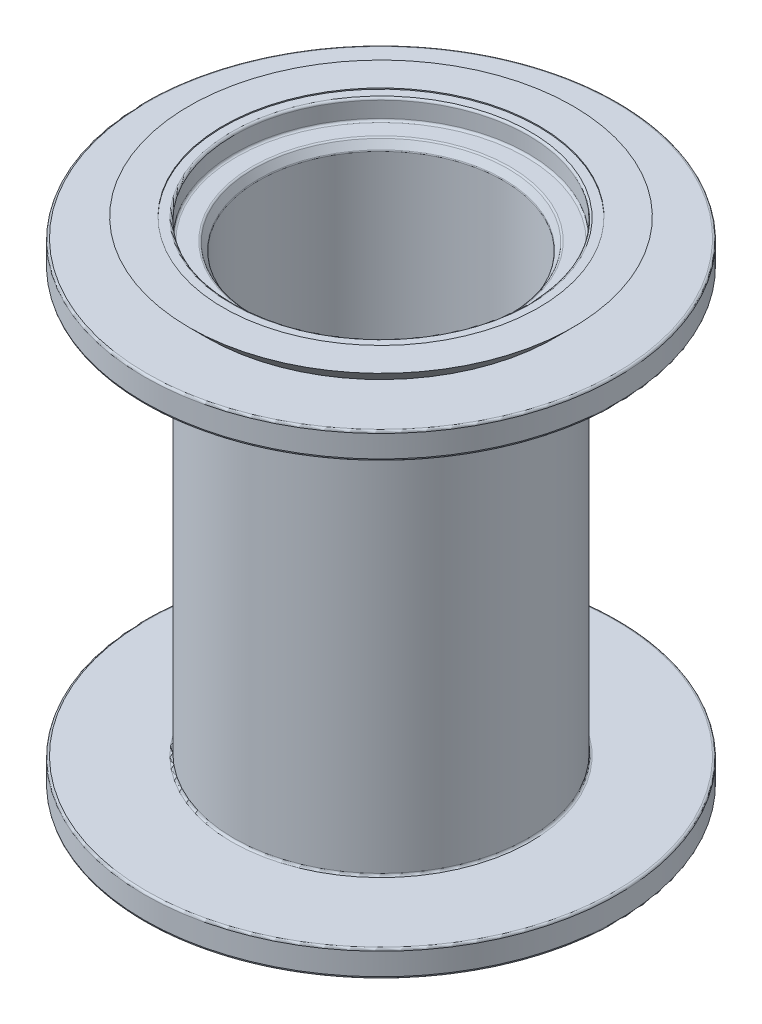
SolidWorks part; units mm, degrees
ref_plane "Plan de face" through (0, 0, 0) normal (0, 0, 1) x (1, 0, 0)
ref_plane "Plan de dessus" through (0, 0, 0) normal (0, 1, 0) x (1, 0, 0)
ref_plane "Plan de droite" through (0, 0, 0) normal (1, 0, 0) x (0, 0, -1)
sketch "Esquisse1" plane through (0, 0, 0) normal (0, 0, 1) x (1, 0, 0)
  line L0 (0, 0) -> (0, 62.8412) construction
  line L1 (10.15, 28.45) -> (10.15, 19.55)
  line L2 (10.15, 19.55) -> (11.65, 19.55)
  line L3 (11.65, 19.55) -> (11.65, 2.55)
  line L4 (12.15, 1.75) -> (14, 1.75)
  line L5 (14, 1.75) -> (14, 0)
  line L6 (14, 0) -> (18.25, 0)
  line L7 (18.25, 0) -> (16.5, 1.75)
  line L8 (16.5, 1.75) -> (22.5, 1.75)
  line L9 (10.15, 28.45) -> (11.65, 28.45)
  line L10 (22.5, 4.25) -> (14, 4.25)
  line L11 (14, 4.25) -> (14, 44.4)
  line L12 (14, 44.4) -> (22.5, 44.4)
  line L13 (22.5, 44.4) -> (22.5, 46.9)
  line L14 (22.5, 46.9) -> (16.5, 46.9)
  line L15 (16.5, 46.9) -> (18.25, 48.65)
  line L16 (18.25, 48.65) -> (15, 48.65)
  line L17 (15, 48.65) -> (15, 48.55)
  line L18 (15, 48.55) -> (14, 48.55)
  line L19 (14, 48.55) -> (14, 46.65)
  line L20 (14, 46.65) -> (12.15, 46.65)
  line L21 (11.65, 45.85) -> (11.65, 28.45)
  line L22 (22.5, 1.75) -> (22.5, 4.25)
  line L23 (12.15, 46.65) -> (11.65, 45.85)
  line L24 (11.65, 2.55) -> (12.15, 1.75)
  dimension "D1" = 23.3
  dimension "D2" = 23.3
  dimension "D3" = 20.3
  dimension "D4" = 0.5
  dimension "D5" = 1.75
  dimension "D6" = 28
  dimension "D7" = 36.5
  dimension "D8" = 45
  dimension "D9" = 2.5
  dimension "D10" = 1.75
  dimension "D11" = 8.9
  dimension "D12" = 0.8
  dimension "D13" = 28
  dimension "D14" = 1.9
  dimension "D15" = 0.1
  dimension "D16" = 28
  dimension "D17" = 1
  dimension "D18" = 36.5
  dimension "D19" = 45
  dimension "D20" = 1.75
  dimension "D21" = 45
  dimension "D22" = 45
  dimension "D23" = 2.5
  dimension "D24" = 0.5
  dimension "D25" = 0.8
  dimension "D26" = 40.15
  dimension "D27" = 19.55
  dimension "D28" = 18.2
revolve "Révolution1" add sketch "Esquisse1" angle 360 about L0
sketch "Esquisse2" plane through (0, 28.45, 0) normal (0, 1, 0) x (-1, 0, 0)
  line L0 (-9.9265, 2.1183) -> (-11.3936, 2.4307)
  line L1 (-8.7481, 5.1471) -> (-10.041, 5.9078)
  arc A0 (-10.041, 5.9078) -> (-11.3936, 2.4307) centre (0, 0) ccw
  arc A1 (-8.7481, 5.1471) -> (-9.9265, 2.1183) centre (0, 0) ccw
  point P4 (-9.9265, 2.1183)
  point P7 (-8.7481, 5.1471)
  dimension "D1" = 3.25
  dimension "D2" = 18.45
extrude "Enlèv. mat.-Extru.1" cut sketch "Esquisse2" against normal blind 7.75
pattern_circular "Répétition circulaire1" count 12 over 360 about axis through (0, 0, 0) along (0, 1, 0) of "Enlèv. mat.-Extru.1"
fillet "Congé1" radius 0.2 58 edges at (0, 19.55, -10.15) (10.0321, 20.7, -1.5426) (10.1497, 24.575, 0.0835) (10.0895, 28.45, 1.1065) (9.9265, 24.575, 2.1183) (9.4593, 20.7, 3.6801) (8.7481, 24.575, 5.1471) (8.1845, 28.45, 6.003) (7.5375, 24.575, 6.7977) (6.3519, 20.7, 7.9168) (5.0026, 24.575, 8.8316) (4.0865, 28.45, 9.291) (3.1288, 24.575, 9.6557) (1.5426, 20.7, 10.0321) (-0.0835, 24.575, 10.1497) (-1.1065, 28.45, 10.0895) (-2.1183, 24.575, 9.9265) (-3.6801, 20.7, 9.4593) (-5.1471, 24.575, 8.7481) (-6.003, 28.45, 8.1845) (-6.7977, 24.575, 7.5375) (-7.9168, 20.7, 6.3519) (-8.8316, 24.575, 5.0026) (-9.291, 28.45, 4.0865) (-9.6557, 24.575, 3.1288) (-10.0321, 20.7, 1.5426) (-10.1497, 24.575, -0.0835) (-10.0895, 28.45, -1.1065) (-9.9265, 24.575, -2.1183) (-9.4593, 20.7, -3.6801) (-8.7481, 24.575, -5.1471) (-8.1845, 28.45, -6.003) (-7.5375, 24.575, -6.7977) (-6.3519, 20.7, -7.9168) (-5.0026, 24.575, -8.8316) (-4.0865, 28.45, -9.291) (-3.1288, 24.575, -9.6557) (-1.5426, 20.7, -10.0321) (0.0835, 24.575, -10.1497) (1.1065, 28.45, -10.0895) (2.1183, 24.575, -9.9265) (3.6801, 20.7, -9.4593) (5.1471, 24.575, -8.7481) (6.003, 28.45, -8.1845) (6.7977, 24.575, -7.5375) (7.9168, 20.7, -6.3519) (8.8316, 24.575, -5.0026) (9.291, 28.45, -4.0865) (9.6557, 24.575, -3.1288) (0, 19.55, -11.65) (0, 0, -14) (0, 1.75, -14) (0, 1.75, -12.15) (0, 2.55, -11.65) (0, 45.85, -11.65) (0, 46.65, -12.15) (0, 46.65, -14) (0, 48.55, -14)
fillet "Congé2" radius 0.2 48 edges at (10.041, 24.575, 5.9078) (10.8574, 20.7, 4.2237) (11.3936, 24.575, 2.4307) (11.5806, 28.45, 1.2697) (11.6496, 24.575, 0.0958) (11.5146, 20.7, -1.7709) (11.0825, 24.575, -3.5918) (10.6639, 28.45, -4.6907) (10.1367, 24.575, -5.7418) (9.0865, 20.7, -7.2909) (7.8018, 24.575, -8.6518) (6.8899, 28.45, -9.3943) (5.9078, 24.575, -10.041) (4.2237, 20.7, -10.8574) (2.4307, 24.575, -11.3936) (1.2697, 28.45, -11.5806) (0.0958, 24.575, -11.6496) (-1.7709, 20.7, -11.5146) (-3.5918, 24.575, -11.0825) (-4.6907, 28.45, -10.6639) (-5.7418, 24.575, -10.1367) (-7.2909, 20.7, -9.0865) (-8.6518, 24.575, -7.8018) (-9.3943, 28.45, -6.8899) (-10.041, 24.575, -5.9078) (-10.8574, 20.7, -4.2237) (-11.3936, 24.575, -2.4307) (-11.5806, 28.45, -1.2697) (-11.6496, 24.575, -0.0958) (-11.5146, 20.7, 1.7709) (-11.0825, 24.575, 3.5918) (-10.6639, 28.45, 4.6907) (-10.1367, 24.575, 5.7418) (-9.0865, 20.7, 7.2909) (-7.8018, 24.575, 8.6518) (-6.8899, 28.45, 9.3943) (-5.9078, 24.575, 10.041) (-4.2237, 20.7, 10.8574) (-2.4307, 24.575, 11.3936) (-1.2697, 28.45, 11.5806) (-0.0958, 24.575, 11.6496) (1.7709, 20.7, 11.5146) (3.5918, 24.575, 11.0825) (4.6907, 28.45, 10.6639) (5.7418, 24.575, 10.1367) (7.2909, 20.7, 9.0865) (8.6518, 24.575, 7.8018) (9.3943, 28.45, 6.8899)
fillet "Congé3" radius 0.2 6 edges at (0, 4.25, -22.5) (0, 4.25, -14) (0, 44.4, -14) (0, 1.75, -22.5) (0, 44.4, -22.5) (0, 46.9, -22.5)
